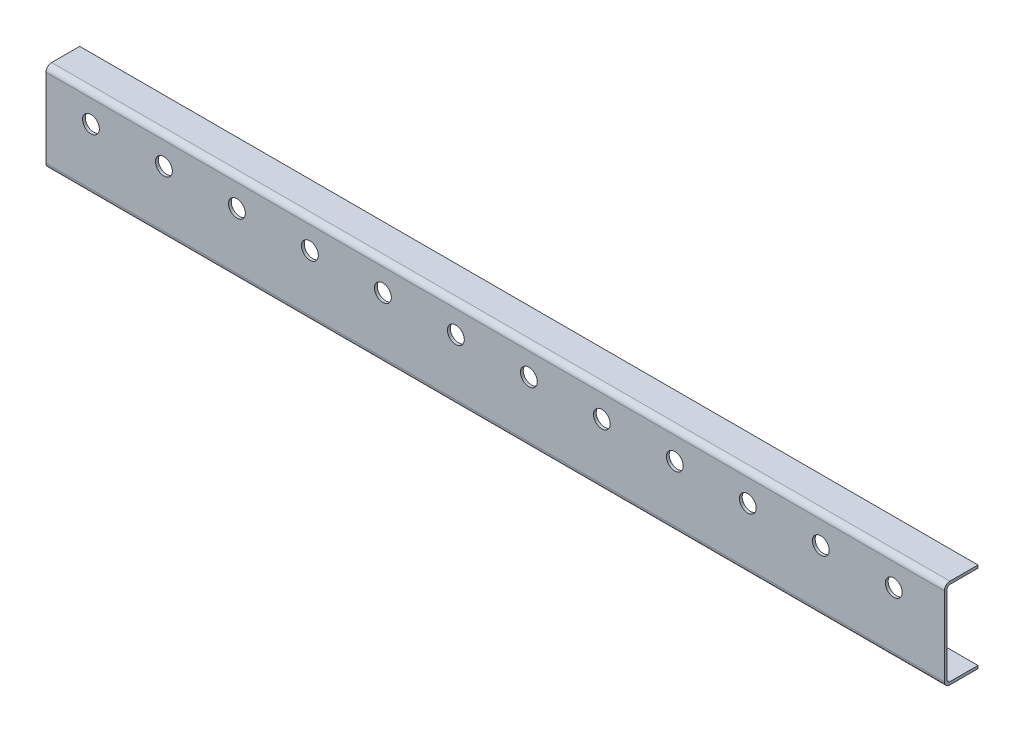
SolidWorks part; units mm, degrees
other "<conv_right_rail>-<LPattern1>"
ref_plane "Plane1" through (0, 0, 0) normal (0, 0, 1) x (1, 0, 0)
ref_plane "Plane2" through (0, 0, 0) normal (0, 1, 0) x (1, 0, 0)
ref_plane "Plane3" through (0, 0, 0) normal (1, 0, 0) x (0, 0, -1)
mirrored part "conv_right_rail_Mirrored"
